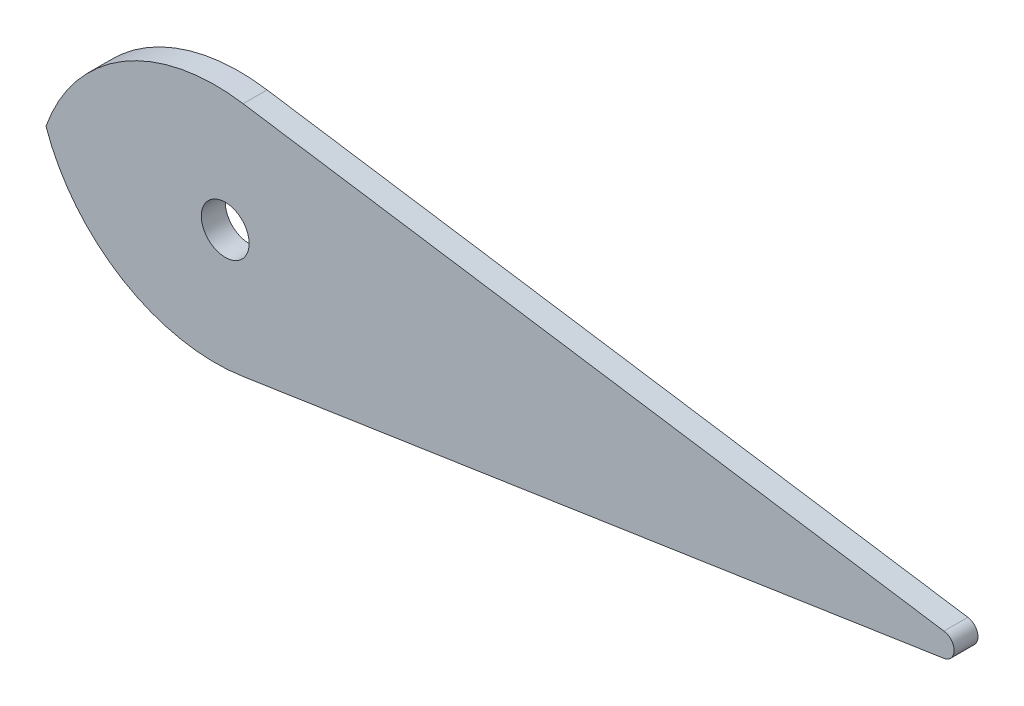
SolidWorks part; units mm, degrees
ref_plane "Front" through (0, 0, 0) normal (0, 0, 1) x (1, 0, 0)
ref_plane "Top" through (0, 0, 0) normal (0, 1, 0) x (1, 0, 0)
ref_plane "Right" through (0, 0, 0) normal (1, 0, 0) x (0, 0, -1)
sketch "Sketch1" plane through (0, 0, 0) normal (0, 0, 1) x (1, 0, 0)
  line L0 (0, 0) -> (3, 0) construction
  line L1 (0, 0) -> (-2.5251, 0) construction
  line L2 (0.075, 0.4943) -> (3.0075, 0.0494)
  line L3 (3.0075, -0.0494) -> (0.075, -0.4943)
  circle A0 centre (0, 0) radius 0.5 construction
  arc A1 (3.0075, -0.0494) -> (3.0075, 0.0494) centre (3, 0) ccw
  arc A2 (-0.75, 0) -> (0.075, 0.4943) centre (-0.0417, -0.2465) cw
  arc A3 (0.075, -0.4943) -> (-0.75, 0) centre (-0.0417, 0.2465) cw
  circle A4 centre (0, 0) radius 0.1
  point P6 (-0.75, 0)
  dimension "D1" = 0.75
  dimension "D2" = 0.1
  dimension "D3" = 1
  dimension "D5" = 0.75
  dimension "D6" = 0.75
  dimension "D7" = 0.2
  dimension "D4" = 3
extrude "Base-Extrude" add sketch "Sketch1" along normal blind 0.1
